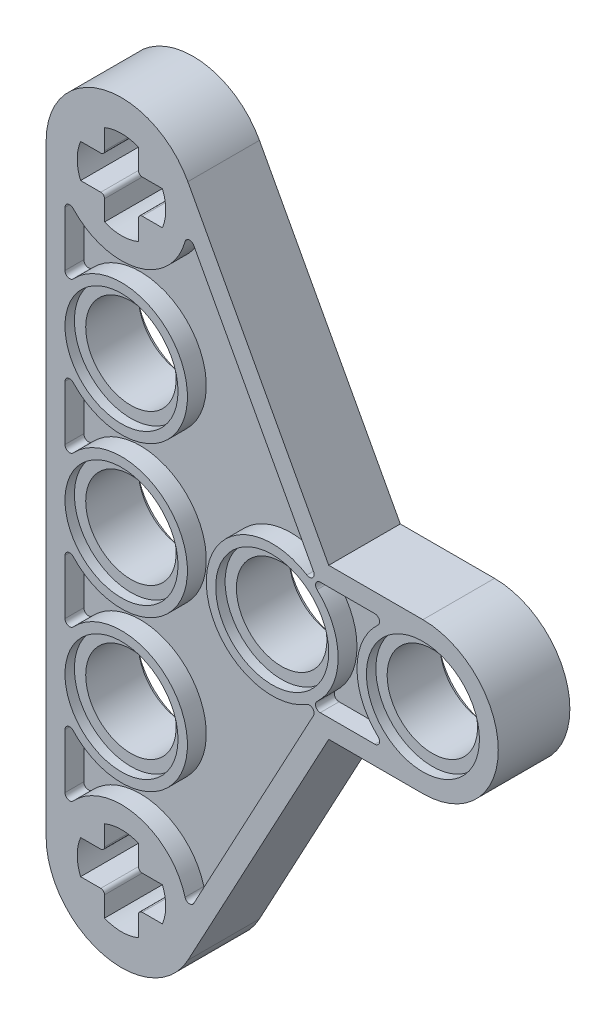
SolidWorks part; units mm, degrees
ref_plane "Alzado" through (0, 0, 0) normal (0, 0, 1) x (1, 0, 0)
ref_plane "Planta" through (0, 0, 0) normal (0, 1, 0) x (1, 0, 0)
ref_plane "Vista lateral" through (0, 0, 0) normal (1, 0, 0) x (0, 0, -1)
sketch "Croquis1" plane through (0, 0, 0) normal (0, 0, 1) x (1, 0, 0)
  line L0 (-5, 4) -> (0, 4)
  line L1 (-18.5, 16) -> (-16, 16) construction
  line L2 (-20, -16) -> (-20, 16)
  line L3 (-20, 0) -> (4, 0) construction
  line L4 (-16, 16) -> (-16, 18.1925) construction
  line L5 (-18.1708, 16.9) -> (-17.1, 16.9)
  line L6 (-16.9, 17.1) -> (-16.9, 18.1708)
  line L7 (-15.1, 17.1) -> (-15.1, 18.1708)
  line L8 (-13.8292, 16.9) -> (-14.9, 16.9)
  line L9 (-13.8292, 15.1) -> (-14.9, 15.1)
  line L10 (-15.1, 14.9) -> (-15.1, 13.8292)
  line L11 (-16.9, 14.9) -> (-16.9, 13.8292)
  line L12 (-18.1708, 15.1) -> (-17.1, 15.1)
  line L13 (-12.4776, 17.8955) -> (-5, 4)
  line L14 (-15.1, -17.1) -> (-15.1, -18.1708)
  line L15 (-16.9, -17.1) -> (-16.9, -18.1708)
  line L16 (-18.1708, -16.9) -> (-17.1, -16.9)
  line L17 (-13.8292, -16.9) -> (-14.9, -16.9)
  line L18 (-18.1708, -15.1) -> (-17.1, -15.1)
  line L19 (-16.9, -14.9) -> (-16.9, -13.8292)
  line L20 (-15.1, -14.9) -> (-15.1, -13.8292)
  line L21 (-13.8292, -15.1) -> (-14.9, -15.1)
  line L22 (-12.4776, -17.8955) -> (-5, -4)
  line L23 (-5, -4) -> (0, -4)
  arc A0 (0, -4) -> (0, 4) centre (0, 0) ccw
  arc A1 (-15.1, 18.1708) -> (-16.9, 18.1708) centre (-16, 16) ccw
  circle A2 centre (-16, 8) radius 2.4
  arc A3 (-18.4, 0) -> (-13.6, 0) centre (-16, 0) ccw
  circle A4 centre (-16, 0) radius 2.4
  circle A5 centre (-8, 0) radius 2.4
  circle A6 centre (0, 0) radius 2.4
  arc A7 (-18.1708, 16.9) -> (-18.1708, 15.1) centre (-16, 16) ccw
  arc A8 (-13.8292, 16.9) -> (-13.8292, 15.1) centre (-16, 16) cw
  arc A9 (-15.1, 13.8292) -> (-16.9, 13.8292) centre (-16, 16) cw
  arc A10 (-17.1, 16.9) -> (-16.9, 17.1) centre (-17.1, 17.1) ccw
  arc A11 (-15.1, 17.1) -> (-14.9, 16.9) centre (-14.9, 17.1) ccw
  arc A12 (-14.9, 15.1) -> (-15.1, 14.9) centre (-14.9, 14.9) ccw
  arc A13 (-16.9, 14.9) -> (-17.1, 15.1) centre (-17.1, 14.9) ccw
  arc A14 (-20, 16) -> (-12.4776, 17.8955) centre (-16, 16) cw
  arc A15 (-15.1, -18.1708) -> (-16.9, -18.1708) centre (-16, -16) cw
  arc A16 (-15.1, -17.1) -> (-14.9, -16.9) centre (-14.9, -17.1) cw
  arc A17 (-17.1, -16.9) -> (-16.9, -17.1) centre (-17.1, -17.1) cw
  arc A18 (-13.8292, -16.9) -> (-13.8292, -15.1) centre (-16, -16) ccw
  arc A19 (-18.1708, -16.9) -> (-18.1708, -15.1) centre (-16, -16) cw
  arc A20 (-16.9, -14.9) -> (-17.1, -15.1) centre (-17.1, -14.9) cw
  arc A21 (-14.9, -15.1) -> (-15.1, -14.9) centre (-14.9, -14.9) cw
  arc A22 (-15.1, -13.8292) -> (-16.9, -13.8292) centre (-16, -16) ccw
  arc A23 (-20, -16) -> (-12.4776, -17.8955) centre (-16, -16) ccw
  circle A24 centre (-16, -8) radius 2.4
  point P37 (-16.9, 16.9)
  point P40 (-15.1, 16.9)
  point P43 (-15.1, 15.1)
  point P46 (-16.9, 15.1)
  dimension "D1" = 4
  dimension "D2" = 20
  dimension "D4" = 16
  dimension "D5" = 8
  dimension "D9" = 2.35
  dimension "D3" = 8
  dimension "D13" = 0.2
  dimension "D14" = 4
  dimension "D7" = 2.4
  dimension "D8" = 8
  dimension "D6" = 16
  dimension "D10" = 1.8
  dimension "D11" = 1.8
  dimension "D15" = 5
extrude "Extruir1" add sketch "Croquis1" along normal mid plane 3.8
sketch "Croquis2" plane through (0, 0, 1.9) normal (0, 0, 1) x (1, 0, 0)
  circle A0 centre (-16, 0) radius 3
  circle A1 centre (-16, 0) radius 2.4 construction
  circle A2 centre (-8, 0) radius 3
  circle A3 centre (0, 0) radius 3
  circle A4 centre (-16, 8) radius 3
  circle A5 centre (-16, -8) radius 3
  dimension "D1" = 6
  dimension "D2" = 8
  dimension "D3" = 16
  dimension "D4" = 8
extrude "Cortar-Extruir1" cut sketch "Croquis2" against normal blind 0.5
sketch "Croquis3" plane through (0, 0, 1.9) normal (0, 0, 1) x (1, 0, 0)
  line L0 (-12.1641, 15.124) -> (-5.8045, 3.306)
  line L1 (-20, 0) -> (0, 0) construction
  line L2 (-20, 16) -> (-20, -16) construction
  line L3 (-5, 4) -> (-12.4776, 17.8955) construction
  line L4 (-19, -5.4505) -> (-19, -2.5495)
  line L5 (-19, -13.4505) -> (-19, -10.5495)
  line L6 (-19, 13.4505) -> (-19, 10.5495)
  line L7 (-12.1641, -15.124) -> (-5.8045, -3.306)
  line L8 (-19, 5.4505) -> (-19, 2.5495)
  line L9 (-5.4505, 3) -> (-2.5495, 3)
  line L10 (-5.4505, -3) -> (-2.5495, -3)
  arc A0 (-6.1563, 2.975) -> (-6.1563, -2.975) centre (-8, 0) ccw
  circle A1 centre (-8, 0) radius 3 construction
  arc A2 (-18.5667, -2.3795) -> (-18.5667, 2.3795) centre (-16, 0) ccw
  arc A3 (-18.5667, 5.6205) -> (-13.25, 5.8349) centre (-16, 8) ccw
  circle A4 centre (-16, 8) radius 2.4 construction
  circle A5 centre (-16, 0) radius 2.4 construction
  circle A6 centre (-16, 8) radius 3 construction
  arc A7 (-13.25, 5.8349) -> (-18.5667, 10.3795) centre (-16, 8) ccw
  arc A8 (-18.5667, 5.6205) -> (-19, 5.4505) centre (-18.75, 5.4505) ccw
  arc A9 (-18.5667, 2.3795) -> (-19, 2.5495) centre (-18.75, 2.5495) cw
  arc A10 (-18.5667, 13.6205) -> (-12.6253, 15.0718) centre (-16, 16) ccw
  arc A11 (-16.9, 13.8292) -> (-15.1, 13.8292) centre (-16, 16) ccw construction
  arc A12 (-12.6253, 15.0718) -> (-12.1641, 15.124) centre (-12.3843, 15.0055) cw
  arc A13 (-18.5667, 13.6205) -> (-19, 13.4505) centre (-18.75, 13.4505) ccw
  arc A14 (-19, 10.5495) -> (-18.5667, 10.3795) centre (-18.75, 10.5495) ccw
  arc A15 (-19, -10.5495) -> (-18.5667, -10.3795) centre (-18.75, -10.5495) cw
  arc A16 (-18.5667, -13.6205) -> (-19, -13.4505) centre (-18.75, -13.4505) cw
  arc A17 (-12.6253, -15.0718) -> (-12.1641, -15.124) centre (-12.3843, -15.0055) ccw
  arc A18 (-18.5667, -13.6205) -> (-12.6253, -15.0718) centre (-16, -16) cw
  arc A19 (-18.5667, -2.3795) -> (-19, -2.5495) centre (-18.75, -2.5495) ccw
  arc A20 (-18.5667, -5.6205) -> (-19, -5.4505) centre (-18.75, -5.4505) cw
  arc A21 (-13.25, -5.8349) -> (-18.5667, -10.3795) centre (-16, -8) cw
  arc A22 (-18.5667, -5.6205) -> (-13.25, -5.8349) centre (-16, -8) cw
  arc A23 (-6.1563, 2.975) -> (-5.8045, 3.306) centre (-6.0246, 3.1875) ccw
  arc A24 (-5.8045, -3.306) -> (-6.1563, -2.975) centre (-6.0246, -3.1875) ccw
  arc A25 (-5.6205, 2.5667) -> (-5.6205, -2.5667) centre (-8, 0) cw
  arc A26 (-2.3795, -2.5667) -> (-2.3795, 2.5667) centre (0, 0) cw
  circle A27 centre (0, 0) radius 3 construction
  arc A28 (-5.6205, 2.5667) -> (-5.4505, 3) centre (-5.4505, 2.75) cw
  arc A29 (-2.3795, 2.5667) -> (-2.5495, 3) centre (-2.5495, 2.75) ccw
  arc A30 (-2.3795, -2.5667) -> (-2.5495, -3) centre (-2.5495, -2.75) cw
  arc A31 (-5.6205, -2.5667) -> (-5.4505, -3) centre (-5.4505, -2.75) ccw
  point P34 (-19, 6.1972)
  point P61 (-4.9179, 1.6586)
  point P64 (-4.9179, -1.6586)
  dimension "D1" = 3.5
  dimension "D2" = 3.5
  dimension "D3" = 7
  dimension "D4" = 0.25
  dimension "D5" = 3.5
  dimension "D6" = 0.25
  dimension "D7" = 0.25
  dimension "D8" = 0.25
  dimension "D9" = 3.5
  dimension "D10" = 3.5
extrude "Cortar-Extruir2" cut sketch "Croquis3" against normal blind 1
mirror "Simetría1" about plane through (0, 0, 0) normal (0, 0, 1) of "Cortar-Extruir2"
mirror "Simetría2" about plane through (0, 0, 0) normal (0, 0, 1) of "Cortar-Extruir1"
